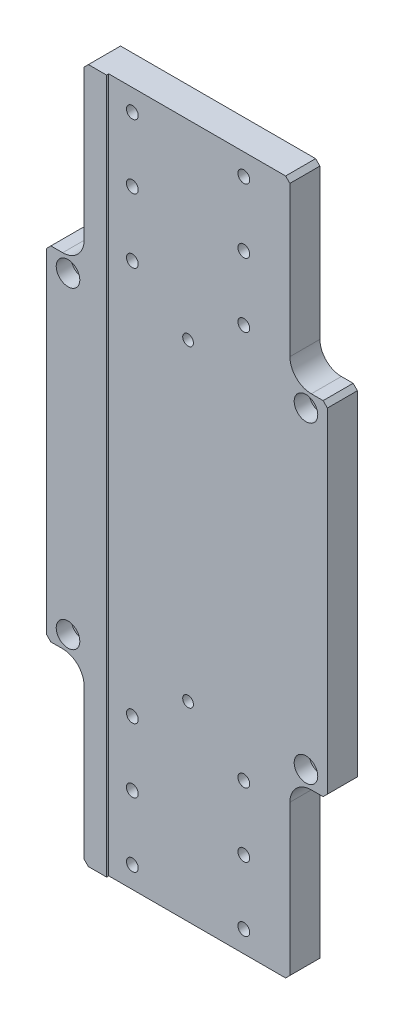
SolidWorks part; units mm, degrees
ref_plane "정면" through (0, 0, 0) normal (0, 0, 1) x (1, 0, 0)
ref_plane "윗면" through (0, 0, 0) normal (0, 1, 0) x (1, 0, 0)
ref_plane "우측면" through (0, 0, 0) normal (1, 0, 0) x (0, 0, -1)
sketch "스케치1" plane through (0, 0, 0) normal (0, 0, 1) x (1, 0, 0)
  line L0 (47.5, 80) -> (65, 80)
  line L1 (-65, 80) -> (-47.5, 80)
  line L2 (-65, 80) -> (-65, -80)
  line L3 (-65, -80) -> (-47.5, -80)
  line L4 (65, 80) -> (65, -80)
  line L5 (-47.5, 162) -> (47.5, 162)
  line L6 (-47.5, 162) -> (-47.5, 80)
  line L7 (-47.5, -162) -> (47.5, -162)
  line L8 (47.5, 162) -> (47.5, 80)
  line L9 (-47.5, 162) -> (47.5, -162) construction
  line L10 (-47.5, -162) -> (47.5, 162) construction
  line L11 (47.5, -80) -> (65, -80)
  line L12 (-47.5, -80) -> (-47.5, -162)
  line L13 (47.5, -80) -> (47.5, -162)
  point P4 (0, 0)
  point P14 (56.25, 80)
  dimension "D1" = 160
  dimension "D2" = 82
  dimension "D3" = 82
  dimension "D4" = 95
  dimension "D5" = 17.5
  dimension "D6" = 17.5
extrude "보스-돌출1" add sketch "스케치1" along normal mid plane 15
sketch "스케치2" plane through (0, 0, 7.5) normal (0, 0, 1) x (1, 0, 0)
  line L0 (47.5, 162) -> (-47.5, 162) construction
  line L1 (-37, 162) -> (65, 162)
  line L2 (-37, 162) -> (-37, -162)
  line L3 (-37, -162) -> (65, -162)
  line L4 (65, 162) -> (65, -162)
  line L5 (65, -80) -> (65, 80) construction
  line L6 (-47.5, -162) -> (47.5, -162) construction
  line L7 (-65, 80) -> (-65, -80) construction
  dimension "D1" = 28
extrude "컷-돌출1" cut sketch "스케치2" against normal blind 1
hole_wizard "Ø5.0mm 맞춤핀 구멍1" positions "스케치3" profile "스케치4" hole size "Ø5.0" standard "ISO"
sketch "스케치3" plane through (0, 0, 6.5) normal (0, 0, 1) x (1, 0, 0)
  line L0 (0, 0) -> (0, 176.1995) construction
  line L1 (47.5, 162) -> (-37, 162) construction
  point P6 (0, 73)
  point P8 (0, -73)
  dimension "D1" = 146
  dimension "D2" = 89
sketch "스케치4" plane through (0, -73, 6.5) normal (1, 0, 0) x (0, -1, 0)
  line L0 (0, 0) -> (0, 14)
  line L1 (0, 14) -> (2.5, 14)
  line L2 (2.5, 14) -> (2.5, 0)
  line L5 (2.5, 0) -> (0, 0)
  line L11 (0, -6.35) -> (0, 107.95) construction
  dimension "관통 구멍 지름" = 5
  dimension "관통 구멍 깊이" = 14
hole_wizard "M6 소켓 머리 캡 나사용 카운터보어1" positions "스케치5" profile "스케치6" counterbore size "M6" standard "KS"
sketch "스케치5" plane through (0, 0, 7.5) normal (0, 0, 1) x (1, 0, 0)
  line L0 (47.5, 162) -> (-37, 162) construction
  line L1 (-65, 80) -> (-65, -80) construction
  point P0 (-55, 73)
  point P2 (-55, -73)
  dimension "D1" = 146
  dimension "D2" = 89
  dimension "D3" = 10
sketch "스케치6" plane through (-55, 73, 7.5) normal (1, 0, 0) x (0, -1, 0)
  line L0 (0, 0) -> (0, 15)
  line L1 (0, 15) -> (3.3, 15)
  line L3 (3.3, 15) -> (3.3, 7)
  line L4 (3.3, 7) -> (5.5, 7)
  line L5 (5.5, 7) -> (5.5, 0)
  line L7 (5.5, 0) -> (0, 0)
  line L11 (0, -6.35) -> (0, 107.95) construction
  dimension "관통 구멍 지름" = 6.6
  dimension "관통 구멍 깊이" = 15
  dimension "카운터보어 지름" = 11
  dimension "카운터보어 깊이" = 7
hole_wizard "M6 소켓 머리 캡 나사용 카운터보어2" positions "스케치7" profile "스케치8" counterbore size "M6" standard "KS"
sketch "스케치7" plane through (0, 0, 6.5) normal (0, 0, 1) x (1, 0, 0)
  line L0 (47.5, 162) -> (-37, 162) construction
  line L1 (65, -80) -> (65, 80) construction
  point P0 (55, 73)
  point P2 (55, -73)
  dimension "D1" = 146
  dimension "D2" = 89
  dimension "D3" = 10
sketch "스케치8" plane through (55, 73, 6.5) normal (1, 0, 0) x (0, -1, 0)
  line L0 (0, 0) -> (0, 14)
  line L1 (0, 14) -> (3.3, 14)
  line L3 (3.3, 14) -> (3.3, 7)
  line L4 (3.3, 7) -> (5.5, 7)
  line L5 (5.5, 7) -> (5.5, 0)
  line L7 (5.5, 0) -> (0, 0)
  line L11 (0, -6.35) -> (0, 107.95) construction
  dimension "관통 구멍 지름" = 6.6
  dimension "관통 구멍 깊이" = 14
  dimension "카운터보어 지름" = 11
  dimension "카운터보어 깊이" = 7
hole_wizard "M5 소켓 머리 캡 나사용 카운터보어1" positions "스케치9" profile "스케치10" counterbore size "M5" standard "KS"
sketch "스케치9" plane through (0, 0, -7.5) normal (0, 0, -1) x (-1, 0, 0)
  line L0 (-47.5, 80) -> (-47.5, 162) construction
  line L2 (-47.5, 162) -> (47.5, 162) construction
  point P0 (-26, 152)
  point P2 (26, 152)
  point P4 (-26, 122)
  point P6 (26, 122)
  point P8 (-26, 92)
  point P10 (26, 92)
  dimension "D1" = 52
  dimension "D2" = 21.5
  dimension "D3" = 10
  dimension "D4" = 30
  dimension "D5" = 30
sketch "스케치10" plane through (26, 152, -7.5) normal (1, 0, 0) x (0, 1, 0)
  line L0 (0, 0) -> (0, 15)
  line L1 (0, 15) -> (2.75, 15)
  line L3 (2.75, 15) -> (2.75, 8)
  line L4 (2.75, 8) -> (4.75, 8)
  line L5 (4.75, 8) -> (4.75, 0)
  line L7 (4.75, 0) -> (0, 0)
  line L11 (0, -6.35) -> (0, 107.95) construction
  dimension "관통 구멍 지름" = 5.5
  dimension "관통 구멍 깊이" = 15
  dimension "카운터보어 지름" = 9.5
  dimension "카운터보어 깊이" = 8
pattern_linear "선형 패턴1" count 2 spacing 244 along (0, -1, 0) of "M5 소켓 머리 캡 나사용 카운터보어1"
fillet "필렛1" radius 10 4 edges at (-47.5, -80, 0) (47.5, -80, -0.5) (47.5, 80, -0.5) (-47.5, 80, 0)
chamfer "모따기1" distance 2 angle 45 8 edges at (-47.5, 162, 0) (47.5, 162, -0.5) (65, 80, -0.5) (65, -80, -0.5) (47.5, -162, -0.5) (-65, 80, 0) (-47.5, -162, 0) (-65, -80, 0)
